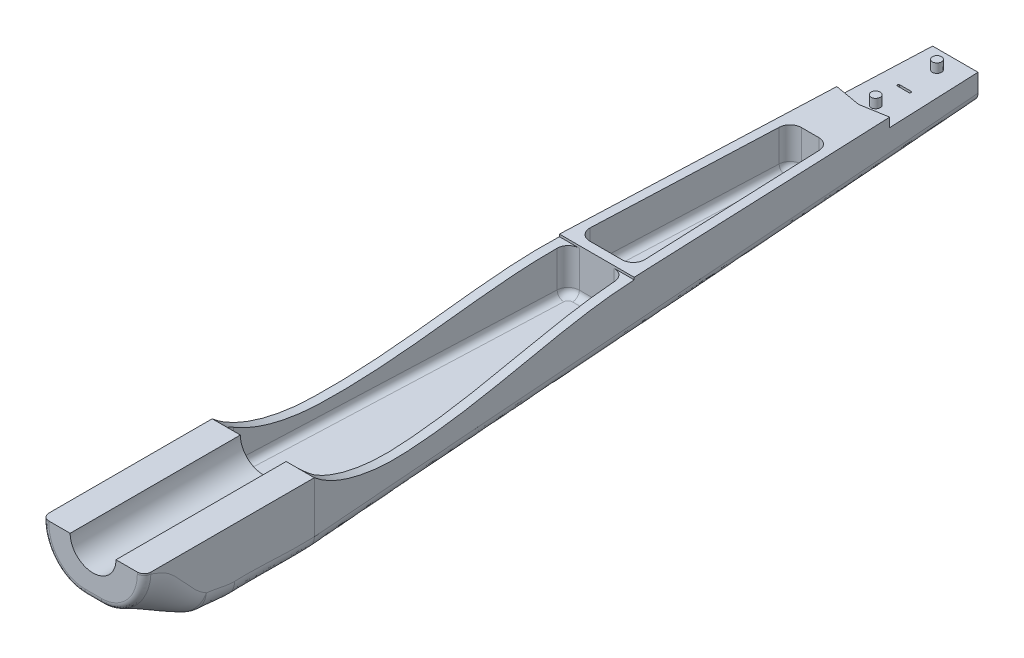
SolidWorks part; units mm, degrees
ref_plane "Plan de face" through (0, 0, 0) normal (0, 0, 1) x (1, 0, 0)
ref_plane "Plan de dessus" through (0, 0, 0) normal (0, 1, 0) x (1, 0, 0)
ref_plane "Plan de droite" through (0, 0, 0) normal (1, 0, 0) x (0, 0, -1)
sketch "Esquisse1" plane through (0, 0, 0) normal (1, 0, 0) x (0, 0, -1)
  line L0 (-79.0921, 0) -> (468.674, 0) construction
  line L1 (0, -48.9798) -> (0, 75.7471) construction
  line L2 (-79.0921, -30) -> (369.8303, -30) construction
  line L3 (-75, 115.3337) -> (-75, -67.2449) construction
  line L4 (305, -67.2449) -> (305, 115.3337) construction
  line L5 (147, -1) -> (147, 0)
  line L6 (147, 0) -> (305, 0)
  line L7 (305, 0) -> (305, -30)
  line L8 (305, -30) -> (-75, -30)
  line L9 (-75, -30) -> (-75, 0)
  line L10 (-75, 0) -> (0, 0)
  line L30 (147, 20.3151) -> (147, -36.2431) construction
  spline S1 degree 3 poles (0, 0) (10.0154, -8.6682) (26.514, -12.1435) (52.9406, -12.2543) (89.4118, -8.6393) (124.8589, -1.0117) (147, -1) knots 0 0 0 0 0.279871 0.279871 0.548423 1 1 1 1
  dimension "D1" = 380
  dimension "D2" = 75
  dimension "D3" = 30
extrude "Boss.-Extru.1" add sketch "Esquisse1" along normal blind 45
sketch "Esquisse2" plane through (0, -30, 0) normal (0, -1, 0) x (1, 0, 0)
  line L0 (22.5, -320.7002) -> (22.5, 87.7123) construction
  line L1 (68.7554, 75) -> (-13.3549, 75) construction
  line L2 (68.7554, 0) -> (-13.3549, 0) construction
  line L3 (32.5, -330.7262) -> (32.5, -265.6212) construction
  line L4 (12.5, -330.7262) -> (12.5, -265.6212) construction
  line L5 (0, -315.9671) -> (0, 87.7123) construction
  line L6 (0, 75) -> (0, -305) construction
  line L7 (45, -315.9671) -> (45, 87.7123) construction
  line L8 (45, 75) -> (45, -305) construction
  line L9 (32.5, -305) -> (45, -305)
  line L10 (45, -305) -> (0, -305) construction
  line L11 (45, -305) -> (45, 0)
  line L12 (45, 0) -> (32.5, -305)
  line L13 (12.5, -305) -> (0, -305)
  line L14 (0, -305) -> (0, 0)
  line L15 (0, 0) -> (12.5, -305)
  dimension "D1" = 75
  dimension "D2" = 20
  dimension "D3" = 10
extrude "Enlèv. mat.-Extru.1" cut sketch "Esquisse2" against normal blind 30
sketch "Esquisse3" plane through (45, 0, 0) normal (1, 0, 0) x (0, 0, -1)
  line L0 (-75, -40.5897) -> (-75, 16.2164) construction
  line L1 (-35, -40.5897) -> (-35, 16.2164) construction
  line L2 (305, -40.5897) -> (305, 24.3565) construction
  line L3 (322.0655, -16) -> (281.8531, -16) construction
  line L4 (322.0655, 0) -> (-110.3259, 0) construction
  line L5 (-86.3852, -30) -> (372.2925, -30) construction
  line L6 (-35, -30) -> (305, -16)
  line L7 (305, -16) -> (305, -30)
  line L8 (305, -30) -> (-35, -30)
  dimension "D1" = 40
  dimension "D2" = 16
extrude "Enlèv. mat.-Extru.2" cut sketch "Esquisse3" against normal blind 45
sketch "Esquisse4" plane through (0, 0, 75) normal (0, 0, 1) x (1, 0, 0)
  line L0 (22.5, 1.6322) -> (22.5, -26.4099) construction
  line L1 (46.5486, 0) -> (-2.9968, 0) construction
  line L2 (12.4, 0) -> (32.6, 0)
  arc A0 (12.4, 0) -> (32.6, 0) centre (22.5, 0) ccw
extrude "Enlèv. mat.-Extru.3" cut sketch "Esquisse4" against normal blind 95
sketch "Esquisse5" plane through (0, 0, 0) normal (-1, 0, 0) x (0, 0, 1)
  line L0 (75, 5.1821) -> (75, -49.0485) construction
  line L1 (50, 5.1821) -> (50, -49.0485) construction
  line L2 (81.8055, -30) -> (-7.1327, -30) construction
  line L3 (84.9179, 0) -> (-11.6597, 0) construction
  line L4 (84.9179, -20) -> (49.6444, -20) construction
  line L5 (75, -20) -> (50, -30)
  line L6 (50, -30) -> (75, -30)
  line L7 (75, -30) -> (75, -20)
  dimension "D1" = 25
  dimension "D2" = 20
extrude "Enlèv. mat.-Extru.4" cut sketch "Esquisse5" against normal blind 45
fillet "Congé variable3" radius 10 4 edges at (6.25, -22.2794, -152.5) (0, -29.2794, 17.5) (0, -30, 42.5) (0, -25, 62.5)
fillet "Congé variable4" radius 10 4 edges at (38.75, -22.2794, -152.5) (45, -29.2794, 17.5) (45, -30, 42.5) (45, -25, 62.5)
fillet "Congé1" radius 3 3 edges at (36.3227, -16.7164, 75) (22.5, -20, 75) (5.1392, -13.5328, 75)
fillet "Congé2" radius 9 3 edges at (41.1526, -27.8856, 49.5785) (3.8474, -27.8856, 49.5785) (22.5, -30, 50)
sketch "Esquisse7" plane through (0, 0, 0) normal (0, 1, 0) x (1, 0, 0)
  line L0 (32.5, 305) -> (12.5, 305)
  line L4 (32.5, 305) -> (34.1629, 264.4246)
  line L5 (10.8379, 264.4458) -> (12.5, 305)
  line L6 (22.5, 255.1586) -> (22.5, 285.649) construction
  line L7 (34.1629, 264.4246) -> (22.5, 262.41)
  line L11 (10.8379, 264.4458) -> (22.5, 262.41)
extrude "Enlèv. mat.-Extru.6" cut sketch "Esquisse7" against normal blind 4
sketch "Esquisse8" plane through (0, -4, 0) normal (0, 1, 0) x (1, 0, 0)
  line L0 (22.5, 310.4782) -> (22.5, 257.9185) construction
  line L1 (8.0809, 305) -> (27.1052, 305) construction
  line L2 (32.5, 305) -> (12.5, 305) construction
  line L3 (8.0809, 296.91) -> (28.1907, 296.91) construction
  line L4 (8.0809, 269.91) -> (28.1907, 269.91) construction
  circle A0 centre (22.5, 296.91) radius 2
  circle A1 centre (22.5, 269.91) radius 2
  dimension "D1" = 8.09
  dimension "D2" = 27
extrude "Boss.-Extru.2" add sketch "Esquisse8" along normal blind 4
sketch "Esquisse9" plane through (0, -28.5105, -1.174) normal (0, -0.9992, -0.0411) x (1, 0, 0)
  line L0 (51.2768, 1.0507) -> (4.1692, 1.0507) construction
  line L1 (51.2768, -3.9493) -> (-1.9886, -3.9493) construction
  line L2 (22.5, 34.475) -> (22.5, -336.5659) construction
  line L3 (30.5, -32.0489) -> (30.5, 8.5902) construction
  line L4 (14.5, -32.0489) -> (14.5, 8.5902) construction
  line L5 (30.5, -3.1993) -> (14.5, -3.1993)
  line L6 (14.5, -4.6993) -> (30.5, -4.6993)
  line L7 (7.4232, -304.0835) -> (42.2193, -304.0835) construction
  line L8 (42.2193, -282.0835) -> (18.0842, -282.0835) construction
  line L9 (25, -268.1032) -> (25, -287.4652) construction
  line L10 (20, -268.1032) -> (20, -287.4652) construction
  line L11 (25, -282.5835) -> (20, -282.5835)
  line L12 (25, -281.5835) -> (20, -281.5835)
  arc A0 (30.5, -4.6993) -> (30.5, -3.1993) centre (30.5, -3.9493) ccw
  arc A1 (14.5, -3.1993) -> (14.5, -4.6993) centre (14.5, -3.9493) ccw
  arc A2 (25, -282.5835) -> (25, -281.5835) centre (25, -282.0835) ccw
  arc A3 (20, -281.5835) -> (20, -282.5835) centre (20, -282.0835) ccw
  dimension "D4" = 22
  dimension "D1" = 5
  dimension "D2" = 16
  dimension "D3" = 8
  dimension "D5" = 5
  dimension "D6" = 2.5
extrude "Enlèv. mat.-Extru.7" cut sketch "Esquisse9" against normal blind 15
ref_plane "Plan1" through (0, 0, 0) normal (0, 1, 0) x (-1, 0, 0)
sketch "Esquisse10" plane through (0, 0, 0) normal (0, 1, 0) x (-1, 0, 0)
  line L0 (-22.5, -155.6187) -> (-22.5, -54.2686) construction
  line L1 (15.3016, 0) -> (-49.0518, 0) construction
  line L2 (15.3016, -147) -> (-49.0518, -147) construction
  line L3 (-41.1272, 3.1849) -> (-34.7309, -152.8835) construction
  line L4 (-45, 0) -> (-38.9754, -147) construction
  line L5 (-40.7833, -5.2047) -> (-35.1686, -142.2047)
  line L6 (-4.2167, -5.2047) -> (-9.8314, -142.2047)
  line L7 (-14.8272, -147) -> (-30.1728, -147)
  line L8 (-9.2125, 0) -> (-35.7875, 0)
  arc A0 (-4.2167, -5.2047) -> (-9.2125, 0) centre (-9.2125, -5) ccw
  arc A1 (-40.7833, -5.2047) -> (-35.7875, 0) centre (-35.7875, -5) cw
  arc A2 (-35.1686, -142.2047) -> (-30.1728, -147) centre (-30.1728, -142) ccw
  arc A3 (-9.8314, -142.2047) -> (-14.8272, -147) centre (-14.8272, -142) cw
  point P18 (-4.0034, 0)
  point P21 (-40.9966, 0)
  point P24 (-34.9721, -147)
  point P27 (-10.0279, -147)
  dimension "D2" = 5
  dimension "D1" = 4
extrude "Enlèv. mat.-Extru.8" cut sketch "Esquisse10" against normal blind 20
fillet "Congé3" radius 3 8 edges at (11.3648, -20, -145.6072) (22.5, -20, -147) (33.6352, -20, -145.6072) (37.976, -20, -73.7047) (39.3947, -20, -1.5376) (22.5, -20, 0) (5.6053, -20, -1.5376) (7.024, -20, -73.7047)
sketch "Esquisse11" plane through (0, 0, 0) normal (0, 1, 0) x (-1, 0, 0)
  line L0 (8.3772, -147) -> (-43.585, -147) construction
  line L1 (-22.5, -151.8301) -> (-22.5, -224.381) construction
  line L2 (8.3772, -151) -> (-43.585, -151) construction
  line L3 (8.3772, -241) -> (-43.585, -241) construction
  line L4 (-35.0418, -145.2985) -> (-30.4201, -258.0671) construction
  line L5 (-38.9754, -147) -> (-34.1629, -264.4246) construction
  line L6 (-34.5948, -156.2047) -> (-31.3161, -236.2047)
  line L7 (-10.4052, -156.2047) -> (-13.6839, -236.2047)
  line L8 (-18.6797, -241) -> (-26.3203, -241)
  line L9 (-15.401, -151) -> (-29.599, -151)
  arc A0 (-10.4052, -156.2047) -> (-15.401, -151) centre (-15.401, -156) ccw
  arc A1 (-34.5948, -156.2047) -> (-29.599, -151) centre (-29.599, -156) cw
  arc A2 (-31.3161, -236.2047) -> (-26.3203, -241) centre (-26.3203, -236) ccw
  arc A3 (-13.6839, -236.2047) -> (-18.6797, -241) centre (-18.6797, -236) cw
  point P19 (-10.1919, -151)
  point P25 (-31.1196, -241)
  point P28 (-13.8804, -241)
  dimension "D4" = 5
  dimension "D1" = 4
  dimension "D2" = 4
  dimension "D3" = 90
extrude "Enlèv. mat.-Extru.9" cut sketch "Esquisse11" against normal blind 17
fillet "Congé4" radius 3 8 edges at (15.2173, -17, -239.6072) (22.5, -17, -241) (29.7827, -17, -239.6072) (32.9555, -17, -196.2047) (33.2062, -17, -152.5376) (22.5, -17, -151) (11.7938, -17, -152.5376) (12.0445, -17, -196.2047)
